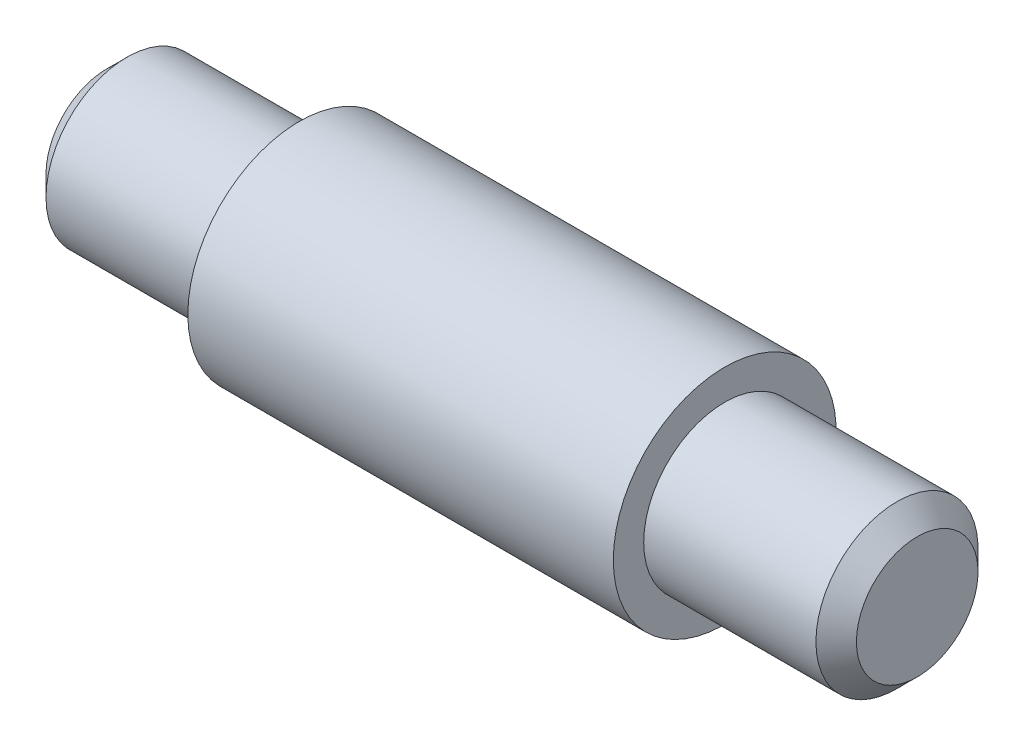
SolidWorks part; units mm, degrees
ref_plane "前基準面" through (0, 0, 0) normal (0, 0, 1) x (1, 0, 0)
ref_plane "上基準面" through (0, 0, 0) normal (0, 1, 0) x (1, 0, 0)
ref_plane "右基準面" through (0, 0, 0) normal (1, 0, 0) x (0, 0, -1)
sketch "草圖1" plane through (0, 0, 0) normal (0, 0, 1) x (1, 0, 0)
  line L0 (0, 0) -> (100.0148, 0) construction
  line L1 (0, 0) -> (0, 11)
  line L2 (0, 11) -> (21, 11)
  line L3 (21, 11) -> (21, 8)
  line L4 (21, 8) -> (40, 8)
  line L5 (40, 8) -> (40, 0)
  line L6 (40, 0) -> (0, 0)
  dimension "D1" = 16
  dimension "D2" = 22
  dimension "D3" = 40
  dimension "D4" = 21
revolve "旋轉1" add sketch "草圖1" angle 360 about L0
chamfer "導角1" distance 2 angle 45 1 edges at (40, 0, 8)
mirror "鏡射1" about plane through (0, 0, 0) normal (1, 0, 0)
